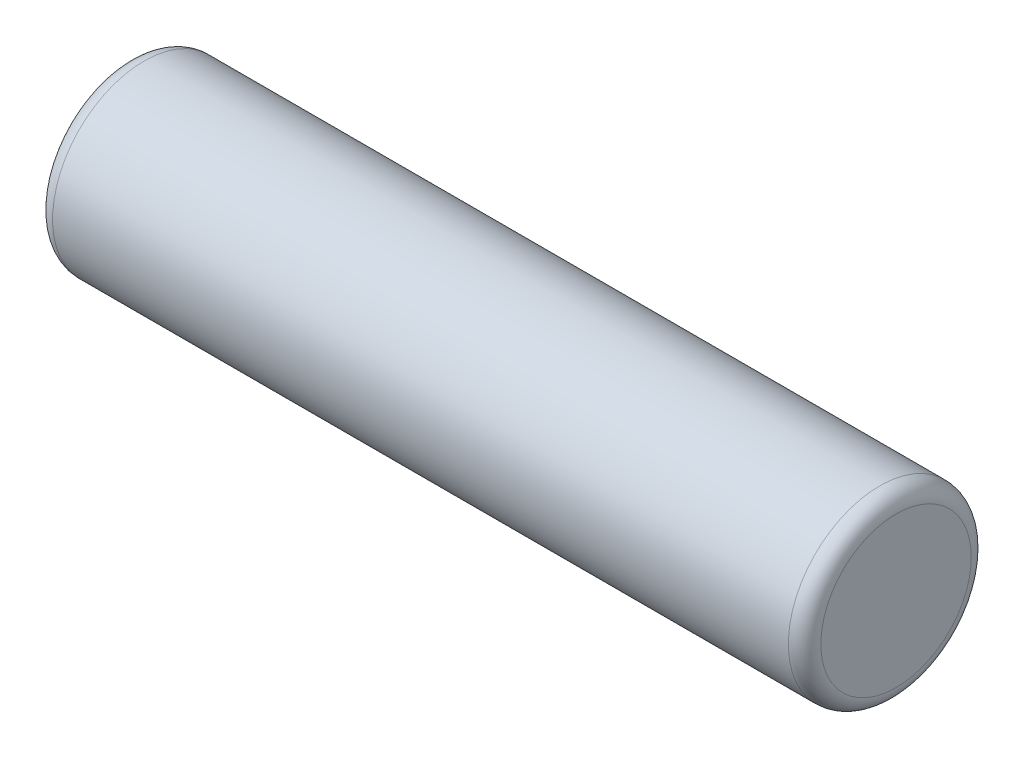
SolidWorks part; units mm, degrees
ref_plane "Front Plane" through (0, 0, 0) normal (0, 0, 1) x (1, 0, 0)
ref_plane "Top Plane" through (0, 0, 0) normal (0, 1, 0) x (1, 0, 0)
ref_plane "Right Plane" through (0, 0, 0) normal (1, 0, 0) x (0, 0, -1)
sketch "Esquisse1" plane through (0, 0, 0) normal (0, 0, 1) x (1, 0, 0)
  line L0 (1.85, 7.3667) -> (1.85, 6.75)
  line L1 (1.85, 6.75) -> (8.15, 6.75)
  line L2 (8.15, 6.75) -> (8.15, 7.3667)
  line L3 (8.0167, 7.5) -> (1.9833, 7.5)
  line L4 (1.8487, 6.75) -> (8.1513, 6.75) construction
  arc A0 (8.15, 7.3667) -> (8.0167, 7.5) centre (8.0167, 7.3667) ccw
  arc A1 (1.9833, 7.5) -> (1.85, 7.3667) centre (1.9833, 7.3667) ccw
revolve "Révolution1" add sketch "Esquisse1" angle 360 about L4
